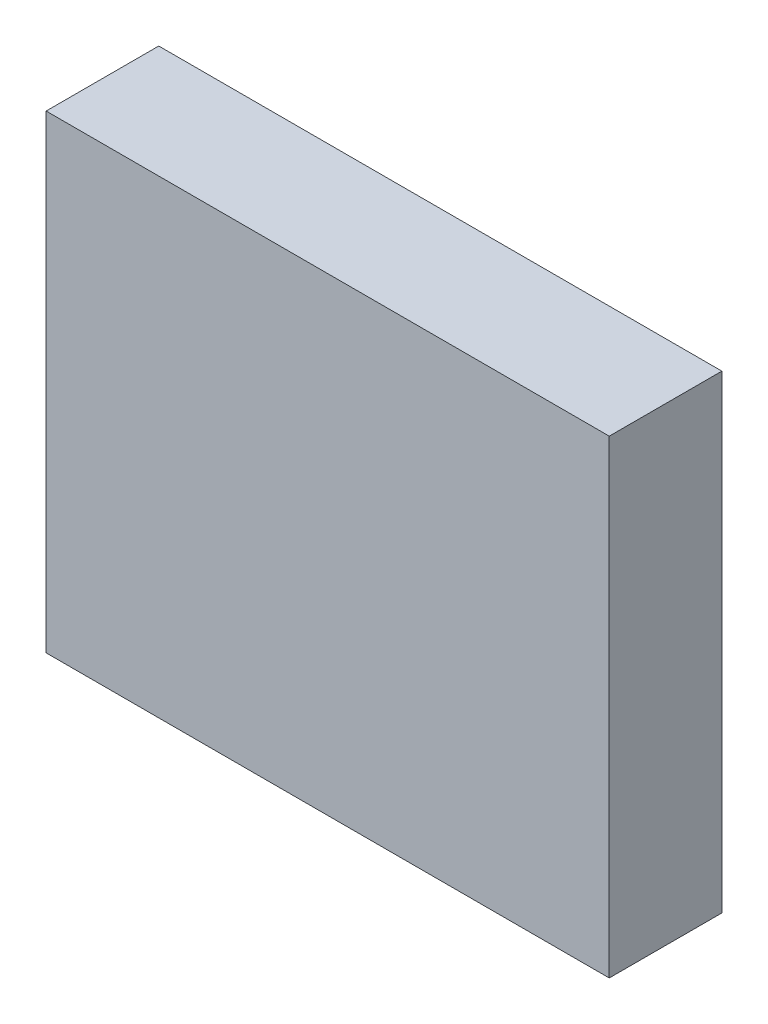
SolidWorks part; units mm, degrees
ref_plane "前视基准面" through (0, 0, 0) normal (0, 0, 1) x (1, 0, 0)
ref_plane "上视基准面" through (0, 0, 0) normal (0, 1, 0) x (1, 0, 0)
ref_plane "右视基准面" through (0, 0, 0) normal (1, 0, 0) x (0, 0, -1)
sketch "草图1" plane through (0, 0, 0) normal (0, 0, 1) x (1, 0, 0)
  line L1 (0, 0) -> (60, 0)
  line L2 (0, 0) -> (0, 50)
  line L3 (0, 50) -> (60, 50)
  line L4 (60, 0) -> (60, 50)
  dimension "D1" = 50
  dimension "D2" = 60
extrude "拉伸1" add sketch "草图1" along normal blind 12
